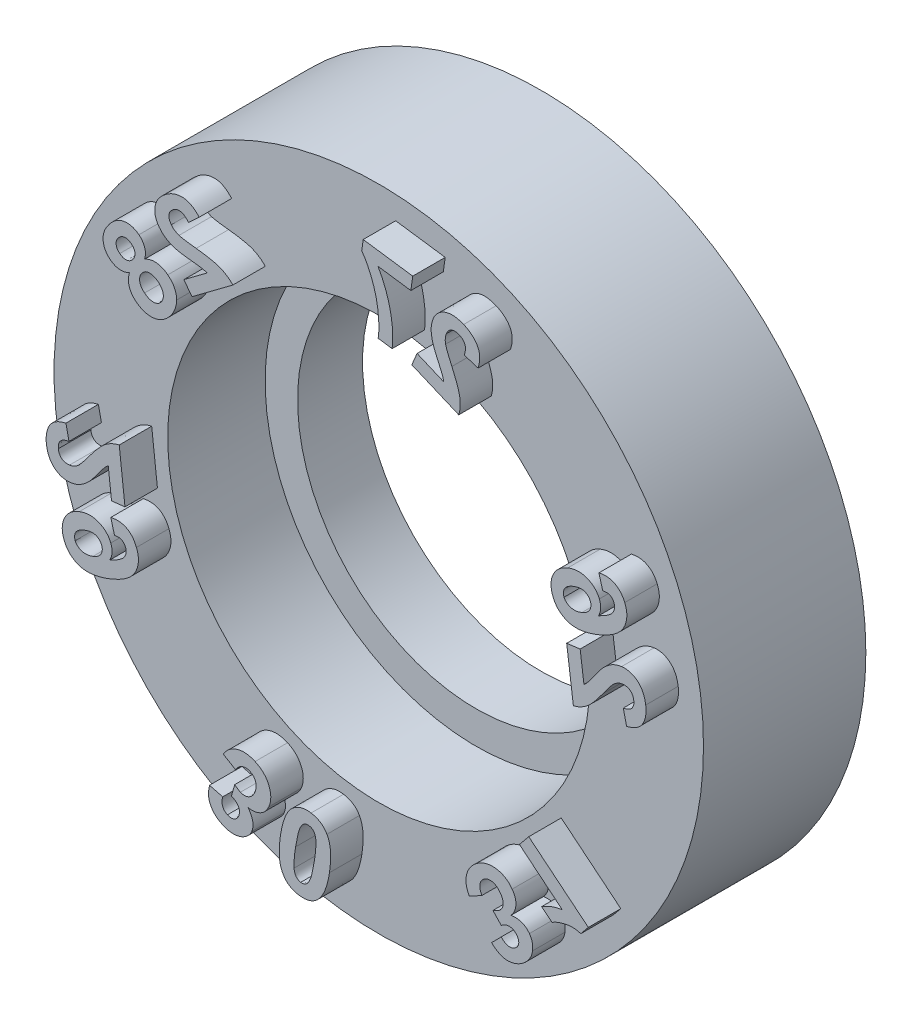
SolidWorks part; units mm, degrees
ref_plane "Front Plane" through (0, 0, 0) normal (0, 0, 1) x (1, 0, 0)
ref_plane "Top Plane" through (0, 0, 0) normal (0, 1, 0) x (1, 0, 0)
ref_plane "Right Plane" through (0, 0, 0) normal (1, 0, 0) x (0, 0, -1)
imported_body "Imported1"
other "DeleteFace1"
sketch "Sketch1" plane through (0, 0, 0) normal (0, 0, 1) x (1, 0, 0)
  line L0 (0, 0) -> (0, 11.8635) construction
  line L1 (0, 0) -> (10.2741, 5.9318) construction
  line L2 (0, 0) -> (10.2741, -5.9318) construction
  line L3 (0, 0) -> (0, -11.8635) construction
  line L4 (0, 0) -> (-10.2741, -5.9318) construction
  line L5 (0, 0) -> (-10.2741, 5.9318) construction
  circle A0 centre (0, 0) radius 7.0035 construction
  text T0 "26    27    28    29    30    31" font "Arial" height 2.37
  point P12 (0, 0)
  dimension "D1" = 6
extrude "Boss-Extrude1" add sketch "Sketch1" along normal blind 1
